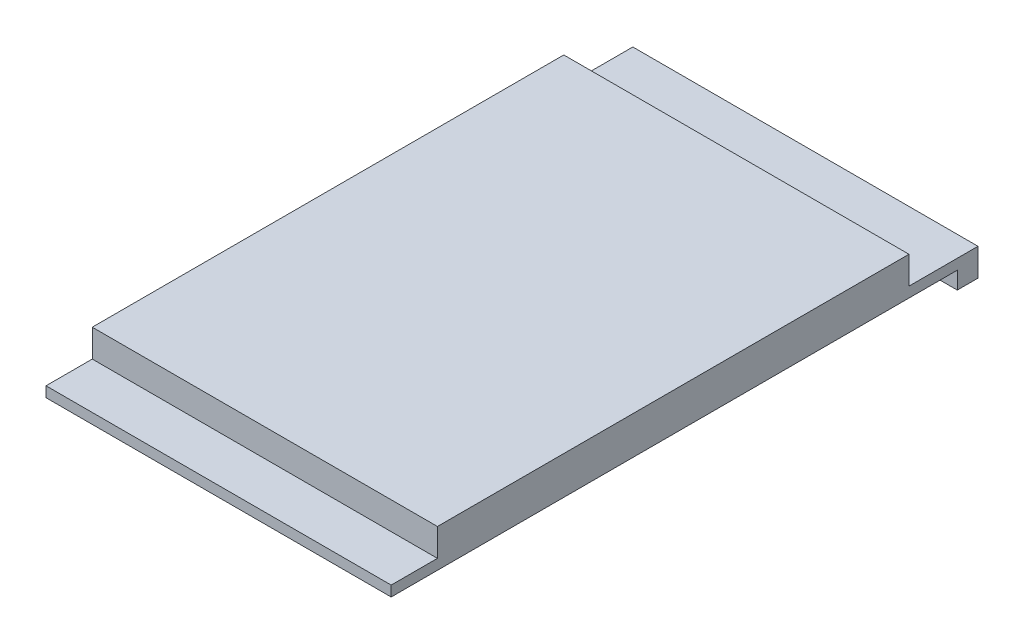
SolidWorks part; units mm, degrees
ref_plane "Front Plane" through (0, 0, 0) normal (0, 0, 1) x (1, 0, 0)
ref_plane "Top Plane" through (0, 0, 0) normal (0, 1, 0) x (1, 0, 0)
ref_plane "Right Plane" through (0, 0, 0) normal (1, 0, 0) x (0, 0, -1)
sketch "Sketch1" plane through (0, 0, 0) normal (0, 1, 0) x (1, 0, 0)
  line L1 (-25, -42.5) -> (25, -42.5)
  line L2 (-25, -42.5) -> (-25, 42.5)
  line L3 (-25, 42.5) -> (25, 42.5)
  line L4 (25, -42.5) -> (25, 42.5)
  line L5 (-25, -42.5) -> (25, 42.5) construction
  line L6 (-25, 42.5) -> (25, -42.5) construction
  point P0 (0, 0)
  dimension "D1" = 85
  dimension "D2" = 50
extrude "Boss-Extrude1" add sketch "Sketch1" along normal blind 8
sketch "Sketch2" plane through (0, 8, 0) normal (0, 1, 0) x (1, 0, 0)
  line L0 (25, -42.5) -> (25, 42.5) construction
  line L1 (-25, 42.5) -> (25, 42.5)
  line L2 (-25, 42.5) -> (-25, 32.5)
  line L3 (-25, 32.5) -> (25, 32.5)
  line L4 (25, 42.5) -> (25, 32.5)
  dimension "D1" = 10
extrude "Cut-Extrude1" cut sketch "Sketch2" against normal blind 4
sketch "Sketch3" plane through (0, 8, 0) normal (0, 1, 0) x (1, 0, 0)
  line L0 (25, -42.5) -> (25, 32.5) construction
  line L1 (-25, -42.5) -> (25, -42.5)
  line L2 (-25, -42.5) -> (-25, -35.8)
  line L3 (-25, -35.8) -> (25, -35.8)
  line L4 (25, -42.5) -> (25, -35.8)
  dimension "D1" = 6.7
extrude "Cut-Extrude2" cut sketch "Sketch3" against normal blind 4
sketch "Sketch4" plane through (0, 0, 0) normal (0, -1, 0) x (1, 0, 0)
  line L0 (-25, -42.5) -> (-25, 42.5) construction
  line L1 (25, 42.5) -> (-25, 42.5)
  line L2 (25, 42.5) -> (25, -39.5)
  line L3 (25, -39.5) -> (-25, -39.5)
  line L4 (-25, 42.5) -> (-25, -39.5)
  dimension "D1" = 82
extrude "Cut-Extrude3" cut sketch "Sketch4" against normal blind 2.5
